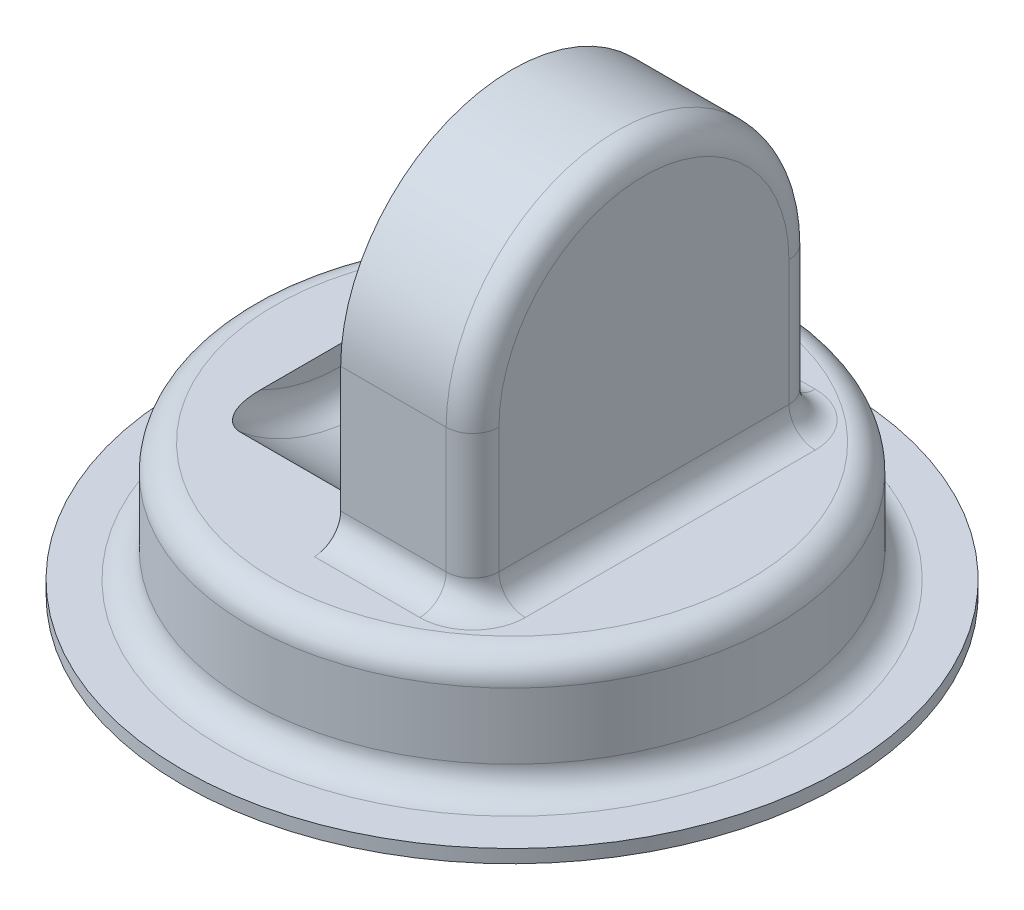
SolidWorks part; units mm, degrees
ref_plane "正面" through (0, 0, 0) normal (0, 0, 1) x (1, 0, 0)
ref_plane "平面" through (0, 0, 0) normal (0, 1, 0) x (1, 0, 0)
ref_plane "右側面" through (0, 0, 0) normal (1, 0, 0) x (0, 0, -1)
sketch "ｽｹｯﾁ1" plane through (0, 0, 0) normal (0, 1, 0) x (1, 0, 0)
  circle A0 centre (0, 0) radius 250
  dimension "D1" = 500
extrude "ﾎﾞｽ - 押し出し1" add sketch "ｽｹｯﾁ1" along normal blind 10
sketch "ｽｹｯﾁ2" plane through (0, 10, 0) normal (0, 1, 0) x (1, 0, 0)
  circle A0 centre (0, 0) radius 200
  dimension "D1" = 400
extrude "ﾎﾞｽ - 押し出し2" add sketch "ｽｹｯﾁ2" along normal blind 90
sketch "ｽｹｯﾁ3" plane through (0, 0, 0) normal (1, 0, 0) x (0, 0, -1)
  line L0 (200, 100) -> (-200, 100) construction
  line L1 (-130, 100) -> (130, 100)
  line L2 (-130, 100) -> (-130, 215)
  line L3 (-130, 215) -> (130, 215) construction
  line L4 (130, 100) -> (130, 215)
  arc A0 (130, 215) -> (-130, 215) centre (0, 215) ccw
  dimension "D2" = 130
  dimension "D1" = 215
extrude "ﾎﾞｽ - 押し出し3" add sketch "ｽｹｯﾁ3" along normal blind 100
sketch "ｽｹｯﾁ4" plane through (0, 0, 0) normal (1, 0, 0) x (0, 0, -1)
  circle A0 centre (0, 215) radius 150
  arc A1 (130, 215) -> (-130, 215) centre (0, 215) ccw construction
  dimension "D1" = 300
extrude "ｶｯﾄ - 押し出し1" cut sketch "ｽｹｯﾁ4" against normal blind 130
fillet "ﾌｨﾚｯﾄ1" radius 20 10 edges at (50, 100, -130) (50, 100, 130) (100, 157.5, -130) (100, 157.5, 130) (0, 65, 0) (-130, 65, 0) (0, 10, 200) (0, 100, 200) (100, 100, 0) (100, 345, 0)
shell "ｼｪﾙ1" thickness 10
sketch "ｽｹｯﾁ5" plane through (0, 0, 0) normal (-1, 0, 0) x (0, 0, 1)
  circle A0 centre (0, 215) radius 50
  arc A1 (130, 215) -> (-130, 215) centre (0, 215) ccw construction
  dimension "D1" = 100
extrude "ｶｯﾄ - 押し出し2" cut sketch "ｽｹｯﾁ5" against normal up to next
